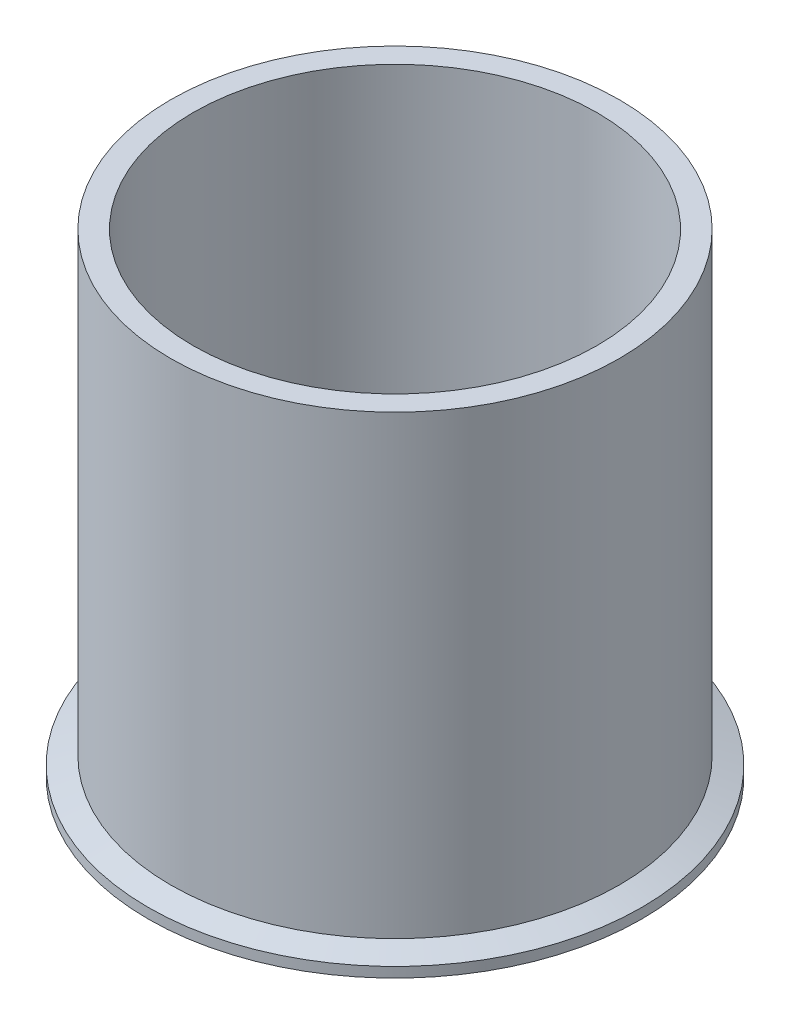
SolidWorks part; units mm, degrees
ref_plane "Front Plane" through (0, 0, 0) normal (0, 0, 1) x (1, 0, 0)
ref_plane "Top Plane" through (0, 0, 0) normal (0, 1, 0) x (1, 0, 0)
ref_plane "Right Plane" through (0, 0, 0) normal (1, 0, 0) x (0, 0, -1)
sketch "Sketch1" plane through (0, 0, 0) normal (0, 0, 1) x (1, 0, 0)
  line L0 (0, 0) -> (0, 114.3) construction
  line L1 (0, 114.3) -> (-54.0512, 114.3)
  line L2 (-54.0512, 114.3) -> (-54.0512, 4.4076)
  line L3 (-54.0512, 4.4076) -> (-59.4614, 2.4384)
  line L4 (-59.4614, 2.4384) -> (-59.4614, 0)
  line L5 (-59.4614, 0) -> (-56.7743, 0)
  line L6 (-52.8267, 0) -> (0, 0)
  line L7 (0, 0) -> (0, 114.3)
  line L8 (0, 114.3) -> (-48.6664, 114.3)
  line L9 (-48.6664, 114.3) -> (-48.6664, 0)
  line L10 (-48.6664, 0) -> (0, 0)
  line L11 (0, 0) -> (-0.1846, 0.0129)
  line L12 (-55.8994, 0.8729) -> (-56.0728, 0.4643)
  line L13 (-54.0512, 4.4076) -> (-56.0728, 4.4076) construction
  line L15 (-53.7016, 0.8729) -> (-53.5282, 0.4643)
  arc A0 (-53.7016, 0.8729) -> (-55.8994, 0.8729) centre (-54.8005, 0.4064) ccw
  arc A1 (-52.8267, 0) -> (-53.5282, 0.4643) centre (-52.8267, 0.762) cw
  arc A2 (-56.7743, 0) -> (-56.0728, 0.4643) centre (-56.7743, 0.762) ccw
  dimension "D6" = 1.1938
  dimension "D7" = 0.4064
  dimension "D4" = 0.762
  dimension "D1" = 54.0512
  dimension "D2" = 20
  dimension "D3" = 59.4614
  dimension "D5" = 54.8005
  dimension "D8" = 5.3848
  dimension "D9" = 114.3
revolve "Revolve2" add sketch "Sketch1" angle 360 about L0
